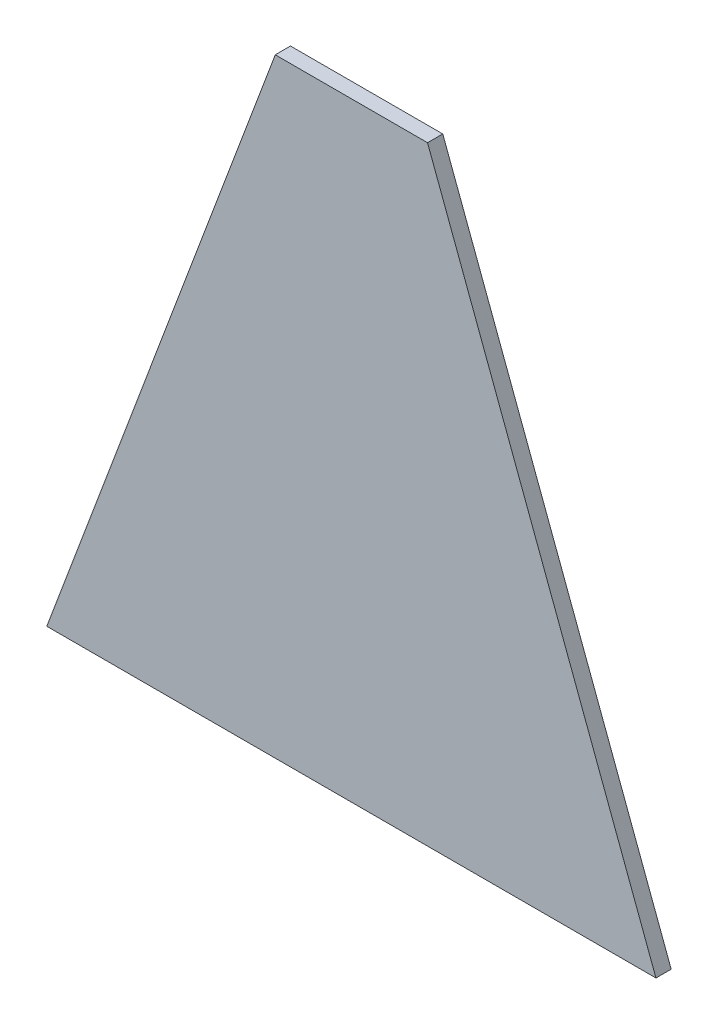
SolidWorks part; units mm, degrees
ref_plane "Front Plane" through (0, 0, 0) normal (0, 0, 1) x (1, 0, 0)
ref_plane "Top Plane" through (0, 0, 0) normal (0, 1, 0) x (1, 0, 0)
ref_plane "Right Plane" through (0, 0, 0) normal (1, 0, 0) x (0, 0, -1)
sketch "Sketch1" plane through (0, 0, 0) normal (0, 0, 1) x (1, 0, 0)
  line L0 (-11.8924, 0) -> (8.1076, 0)
  line L1 (8.1076, 0) -> (38.1076, -80)
  line L2 (38.1076, -80) -> (-41.8924, -80)
  line L3 (-41.8924, -80) -> (-11.8924, 0)
  dimension "D1" = 20
  dimension "D2" = 80
  dimension "D3" = 80
extrude "Boss-Extrude1" add sketch "Sketch1" along normal blind 2
